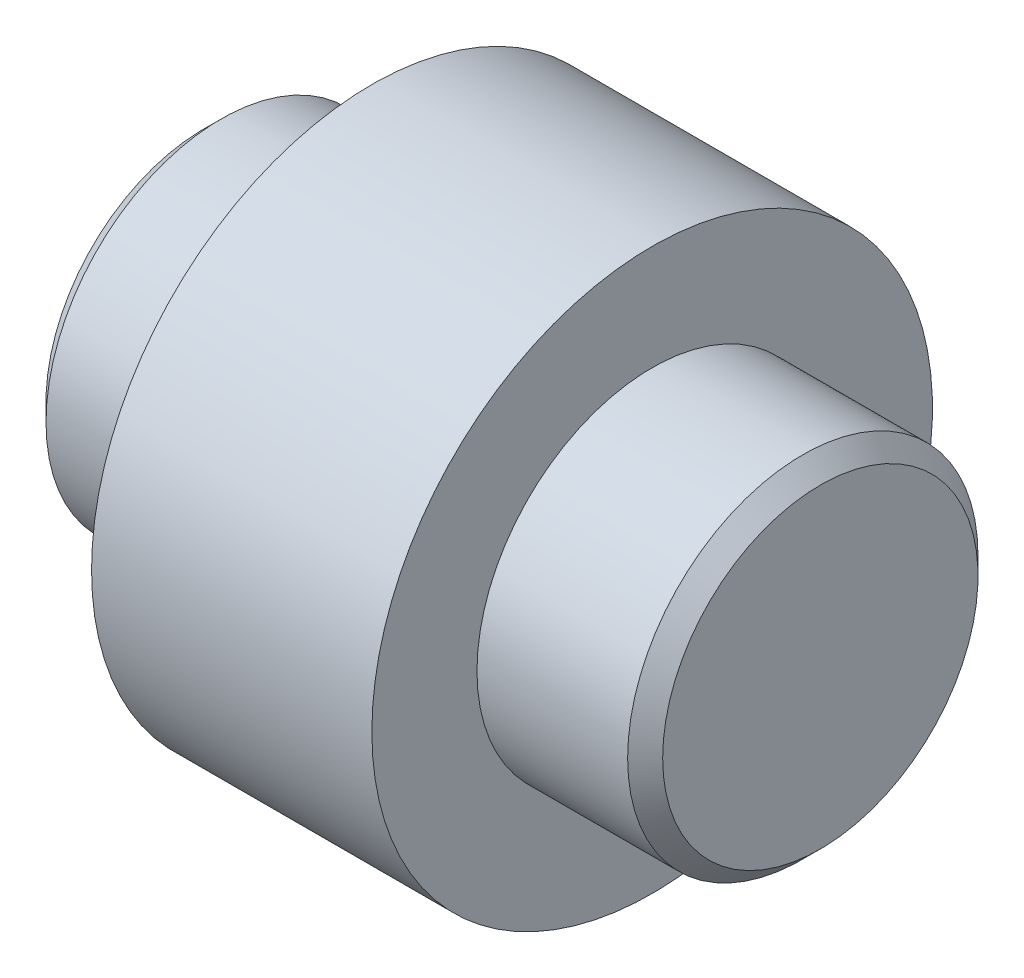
SolidWorks part; units mm, degrees
ref_plane "Plan de face" through (0, 0, 0) normal (0, 0, 1) x (1, 0, 0)
ref_plane "Plan de dessus" through (0, 0, 0) normal (0, 1, 0) x (1, 0, 0)
ref_plane "Plan de droite" through (0, 0, 0) normal (1, 0, 0) x (0, 0, -1)
sketch "Esquisse1" plane through (0, 0, 0) normal (0, 0, 1) x (1, 0, 0)
  line L0 (0, 0) -> (27.1173, 0) construction
  line L1 (0, 0) -> (0, 2.5)
  line L2 (0, 2.5) -> (2.4, 2.5)
  line L3 (2.4, 2.5) -> (2.4, 4)
  line L4 (2.4, 4) -> (6.4, 4)
  line L5 (6.4, 4) -> (6.4, 2.5)
  line L6 (6.4, 2.5) -> (8.8, 2.5)
  line L7 (8.8, 2.5) -> (8.8, 0)
  line L8 (0, 0) -> (8.8, 0)
  dimension "D1" = 5
  dimension "D2" = 8
  dimension "D3" = 4
  dimension "D4" = 2.4
revolve "Révolution1" add sketch "Esquisse1" angle 360 about L0
chamfer "Chanfrein1" distance 0.25 angle 45 2 edges at (0, 0, 2.5) (8.8, 0, 2.5)
